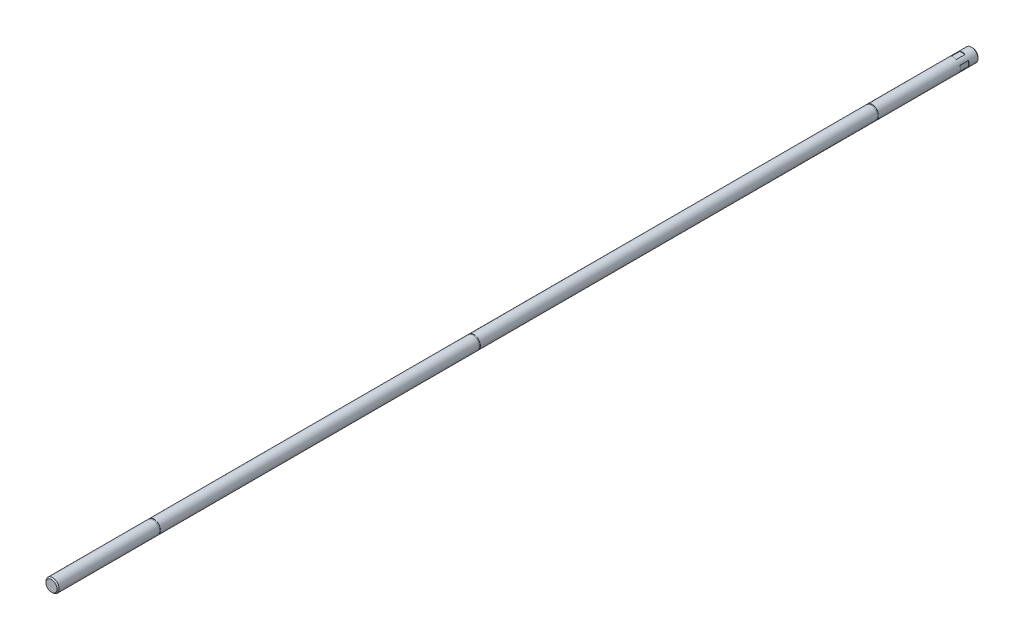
SolidWorks part; units mm, degrees
ref_plane "前视基准面" through (0, 0, 0) normal (0, 0, 1) x (1, 0, 0)
ref_plane "上视基准面" through (0, 0, 0) normal (0, 1, 0) x (1, 0, 0)
ref_plane "右视基准面" through (0, 0, 0) normal (1, 0, 0) x (0, 0, -1)
sketch "草图1" plane through (0, 0, 0) normal (0, 0, 1) x (1, 0, 0)
  circle A0 centre (0, 0) radius 6
  dimension "D1" = 12
extrude "凸台-拉伸1" add sketch "草图1" along normal blind 835
sketch "草图2" plane through (0, 0, 0) normal (0, 0, 1) x (1, 0, 0)
  line L1 (-2.3979, 5.5) -> (2.3979, 5.5)
  line L2 (-2.3979, 5.5) -> (-2.3979, 10.5)
  line L3 (-2.3979, 10.5) -> (2.3979, 10.5)
  line L4 (2.3979, 5.5) -> (2.3979, 10.5)
  circle A0 centre (0, 0) radius 6 construction
  dimension "D1" = 5
  dimension "D2" = 5.5
extrude "切除-拉伸1" cut sketch "草图2" along normal blind 8 from offset 9
pattern_circular "阵列(圆周)1" count 4 over 360 about axis through (0, 0, 0) along (0, 0, 1) of "切除-拉伸1"
ref_axis "基准轴1" through (0, 0, 835) along (0, 0, -1)
sketch "草图4" plane through (0, 0, 0) normal (0, 1, 0) x (1, 0, 0)
  line L0 (6, -835) -> (6, -17) construction
  line L1 (6, -742.1) -> (5.75, -742.1)
  line L2 (6, -742.1) -> (6, -743.2)
  line L3 (6, -743.2) -> (5.75, -743.2)
  line L4 (5.75, -742.1) -> (5.75, -743.2)
  line L6 (6, -91) -> (5.75, -91)
  line L7 (6, -91) -> (6, -92.1)
  line L8 (6, -92.1) -> (5.75, -92.1)
  line L9 (5.75, -91) -> (5.75, -92.1)
  line L11 (6, -835) -> (6, -17) construction
  line L12 (6, -452.1) -> (5.75, -452.1)
  line L13 (6, -452.1) -> (6, -453.2)
  line L14 (6, -453.2) -> (5.75, -453.2)
  line L15 (5.75, -452.1) -> (5.75, -453.2)
  line L16 (6, 0) -> (-6, 0) construction
  dimension "D1" = 91
  dimension "D2" = 650
  dimension "D3" = 360
  dimension "D4" = 1.1
  dimension "D5" = 1.1
revolve "切除-旋转1" cut sketch "草图4" angle 360 about axis through (0, 0, 835) along (0, 0, -1)
chamfer "倒角2" distance 1 angle 45 2 edges at (6, 0, 835) (6, 0, 0)
